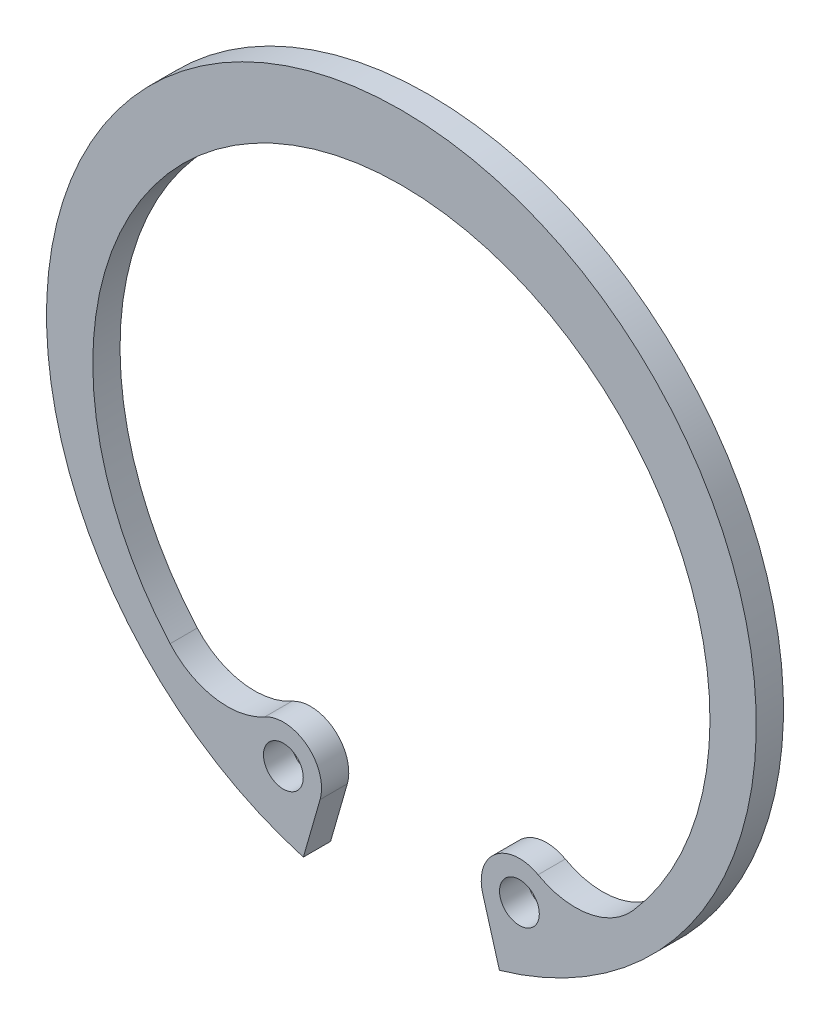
SolidWorks part; units mm, degrees
ref_plane "Plane1" through (0, 0, 0) normal (0, 0, 1) x (1, 0, 0)
ref_plane "Plane2" through (0, 0, 0) normal (0, 1, 0) x (1, 0, 0)
ref_plane "Plane3" through (0, 0, 0) normal (1, 0, 0) x (0, 0, -1)
sketch "Clipboard" plane through (0, 0, 0) normal (0, 0, 1) x (1, 0, 0)
  line L0 (0, 0) -> (3.1, 0)
  line L1 (0, 0) -> (0, 1.6)
  line L2 (0, 0) -> (0, -4.6)
  circle A0 centre (0, 0) radius 0.95
  circle A1 centre (0, 0) radius 16
  dimension "HoleDia" = 1.9
  dimension "BoreDia" = 32
  dimension "LargeSection" = 3.1
  dimension "SmallSection" = 1.6
  dimension "LugSection" = 4.6
sketch "BodySke" plane through (0, 0, 0) normal (0, 0, 1) x (1, 0, 0)
  line L0 (-1.5431, 0) -> (1.5431, 0) construction
  line L1 (0, 0) -> (0, 13.85) construction
  line L2 (4.6821, -16.2905) -> (3.883, -13.5101)
  line L3 (-4.6821, -16.2905) -> (-3.883, -13.5101)
  line L4 (0, 0) -> (12.0453, -11.9254) construction
  line L5 (0, 0) -> (-12.0453, -11.9254) construction
  line L6 (-5.3746, -12.0929) -> (-5.8994, -13.919) construction
  line L7 (5.4296, -12.2846) -> (5.8443, -13.7273) construction
  arc A0 (-3.883, -13.5101) -> (-6.5284, -11.4135) centre (-5.637, -13.006) ccw
  arc A1 (6.5284, -11.4135) -> (3.883, -13.5101) centre (5.637, -13.006) ccw
  arc A2 (10.9082, -10.7997) -> (-10.9082, -10.7997) centre (0, -0.8885) ccw construction
  arc A3 (4.6821, -16.2905) -> (-4.6821, -16.2905) centre (0, 0) ccw
  circle A4 centre (5.637, -13.006) radius 0.95
  circle A5 centre (-5.637, -13.006) radius 0.95
  arc A7 (11.0471, -10.6447) -> (-11.0471, -10.6447) centre (0, -0.8885) ccw
  arc A8 (-5.637, -13.006) -> (5.637, -13.006) centre (0, 0) ccw construction
  arc A9 (-11.0471, -10.6447) -> (-6.5284, -11.4135) centre (-8.3113, -8.2285) ccw
  arc A10 (6.5284, -11.4135) -> (11.0471, -10.6447) centre (8.3113, -8.2285) ccw
  dimension "GrooveDia" = 33.9
  dimension "TipRad" = 1.825
  dimension "HoleOffsetRad" = 14.175
  dimension "HoleDia" = 1.9
  dimension "FilletRad" = 3.65
  dimension "LargeRad" = 13.85
  dimension "SmallRad" = 15.35
  dimension "SmallAngle" = 90.573
  dimension "GapAngle" = 32.071
extrude "Body" add sketch "BodySke" against normal blind 1.3
sketch "ModLugSke" plane through (0, 0, 0) normal (0, 0, 1) x (1, 0, 0)
  line L0 (4.6821, -16.2905) -> (3.6645, -12.7499)
  line L1 (-4.6821, -16.2905) -> (-3.6645, -12.7499)
  line L2 (8.8183, -8.6464) -> (12.1028, -11.867) construction
  line L3 (-8.8183, -8.6464) -> (-12.1028, -11.867) construction
  line L4 (-4.6821, -16.2905) -> (-3.883, -13.5101) construction
  line L5 (3.883, -13.5101) -> (4.6821, -16.2905) construction
  line L6 (0, 0) -> (0, -12.7358) construction
  line L7 (10.9556, -10.7421) -> (12.1028, -11.867)
  line L8 (-12.1028, -11.867) -> (-10.9556, -10.7421)
  arc A0 (4.6821, -16.2905) -> (12.1028, -11.867) centre (0, 0) ccw
  arc A1 (-5.872, -10.8647) -> (-4.2506, -11.5955) centre (0, 0) ccw
  arc A2 (4.6821, -16.2905) -> (-4.6821, -16.2905) centre (0, 0) ccw construction
  arc A3 (6.5284, -11.4135) -> (3.883, -13.5101) centre (5.637, -13.006) ccw construction
  arc A4 (-5.872, -10.8647) -> (-6.9247, -10.9647) centre (-6.3237, -11.7005) ccw
  arc A5 (-10.9556, -10.7421) -> (-6.9247, -10.9647) centre (-8.8183, -8.6464) ccw
  arc A6 (11.0471, -10.6447) -> (-11.0471, -10.6447) centre (0, -0.8885) ccw construction
  arc A7 (6.9247, -10.9647) -> (10.9556, -10.7421) centre (8.8183, -8.6464) ccw
  arc A8 (4.2506, -11.5955) -> (5.872, -10.8647) centre (0, 0) ccw
  arc A9 (-12.1028, -11.867) -> (-4.6821, -16.2905) centre (0, 0) ccw
  circle A10 centre (-5.637, -13.006) radius 0.95
  circle A11 centre (-5.637, -13.006) radius 0.95 construction
  circle A12 centre (5.637, -13.006) radius 0.95
  circle A13 centre (5.637, -13.006) radius 0.95 construction
  arc A14 (-4.2506, -11.5955) -> (-3.6645, -12.7499) centre (-4.5775, -12.4874) cw
  arc A15 (4.2506, -11.5955) -> (3.6645, -12.7499) centre (4.5775, -12.4874) ccw
  arc A16 (5.872, -10.8647) -> (6.9247, -10.9647) centre (6.3237, -11.7005) cw
  point P43 (3.4115, -11.8695)
  dimension "LugAng" = 56.78
extrude "ModLug" [suppressed] add sketch "ModLugSke" against normal through all
equation "' \"BoreDia@Clipboard\" = 8"
equation "' \"Thickness@Body\" = 0.4"
equation "' \"GrooveDia@BodySke\" = 8.4"
equation "' \"LugSection@Clipboard\" = 1.7"
equation "' \"LargeSection@Clipboard\" = 0.85"
equation "' \"SmallSection@Clipboard\" = 0.45"
equation "' \"HoleDia@Clipboard\" = 0.8"
equation "' \"BoreDia@Clipboard\" = 25"
equation "' \"Thickness@Body\" = 1.1"
equation "' \"GrooveDia@BodySke\" = 26.6"
equation "' \"LugSection@Clipboard\" = 4"
equation "' \"LargeSection@Clipboard\" = 2.6"
equation "' \"SmallSection@Clipboard\" = 1.3"
equation "' \"HoleDia@Clipboard\" = 1.5"
equation "\"TipRad@BodySke\" = (\"LugSection@Clipboard\" - (\"GrooveDia@BodySke\" / 2  -  \"BoreDia@Clipboard\" / 2 ) ) / 2"
equation "\"HoleOffsetRad@BodySke\" = (\"GrooveDia@BodySke\" / 2) - \"LugSection@Clipboard\"  + \"TipRad@BodySke\""
equation "\"LargeRad@BodySke\" =  \"GrooveDia@BodySke\" / 2 -  \"LargeSection@Clipboard\""
equation "\"SmallRad@BodySke\" =  \"GrooveDia@BodySke\" / 2 -  \"SmallSection@Clipboard\""
equation "\"HoleDia@BodySke\" =  \"HoleDia@Clipboard\""
equation "\"FilletRad@BodySke\" = \"TipRad@BodySke\" * 2"
equation "\"GapAngle@BodySke\" = 360 - 0.965 * 360 * ( \"BoreDia@Clipboard\" /  \"GrooveDia@BodySke\")"
equation "\"LugAng@ModLugSke\" = \"GapAngle@BodySke\"  + 1.5 * 360 * (\"LugSection@Clipboard\" / (\"BoreDia@Clipboard\" * 3.1416))"
